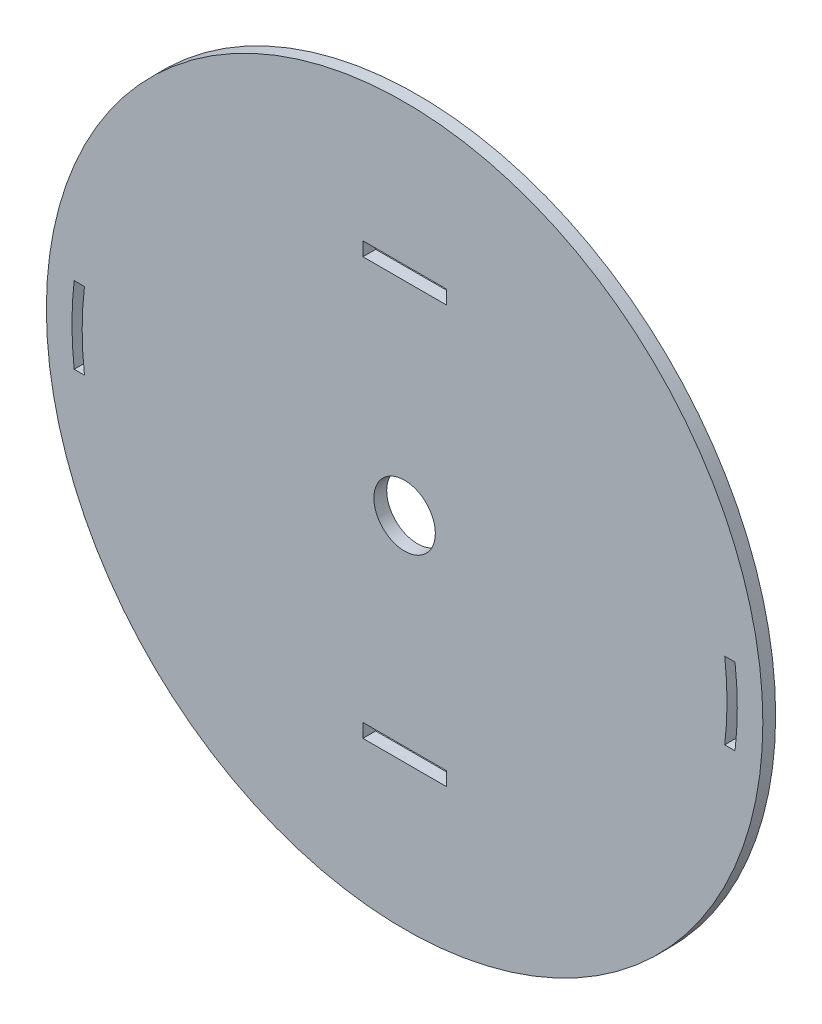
SolidWorks part; units mm, degrees
ref_plane "Front Plane" through (0, 0, 0) normal (0, 0, 1) x (1, 0, 0)
ref_plane "Top Plane" through (0, 0, 0) normal (0, 1, 0) x (1, 0, 0)
ref_plane "Right Plane" through (0, 0, 0) normal (1, 0, 0) x (0, 0, -1)
sketch "Sketch1" plane through (0, 0, 0) normal (0, 0, 1) x (1, 0, 0)
  line L0 (62.552, 31.6553) -> (64.5659, 31.6553)
  line L1 (-64.5659, 46.6553) -> (-62.552, 46.6553)
  line L3 (-64.5659, 31.6553) -> (-62.552, 31.6553)
  line L5 (-8.1491, 78.9) -> (8.1491, 78.9)
  line L6 (8.1491, 78.9) -> (8.1491, 81.6)
  line L7 (8.1491, 81.6) -> (-8.1491, 81.6)
  line L8 (-8.1491, 81.6) -> (-8.1491, 78.9)
  line L9 (62.552, 46.6553) -> (64.5659, 46.6553)
  line L10 (8.1491, 0.1) -> (-8.1491, 0.1)
  line L11 (-8.1491, 0.1) -> (-8.1491, -2.6)
  line L26 (-8.1491, -2.6) -> (8.1491, -2.6)
  line L27 (8.1491, -2.6) -> (8.1491, 0.1)
  circle A0 centre (0, 39.1553) radius 70
  arc A1 (64.5659, 31.6553) -> (64.5659, 46.6553) centre (0, 39.1553) ccw
  arc A2 (62.552, 31.6553) -> (62.552, 46.6553) centre (0, 39.1553) ccw
  arc A3 (-62.552, 46.6553) -> (-62.552, 31.6553) centre (0, 39.1553) ccw
  arc A4 (-64.5659, 46.6553) -> (-64.5659, 31.6553) centre (0, 39.1553) ccw
  dimension "D1" = 140
  dimension "D2" = 65
  dimension "D3" = 63
  dimension "D4" = 8.1491
  dimension "D5" = 62.552
  dimension "D6" = 0.1
  dimension "D7" = 8.1491
  dimension "D8" = 31.6553
  dimension "D9" = 78.9
  dimension "D10" = 81.6
extrude "Boss-Extrude2" add sketch "Sketch1" along normal blind 2.5
sketch "Sketch2" plane through (0, 0, 0) normal (0, 0, -1) x (-1, 0, 0)
  circle A0 centre (0, 39.1553) radius 6
extrude "Cut-Extrude1" cut sketch "Sketch2" against normal blind 10
